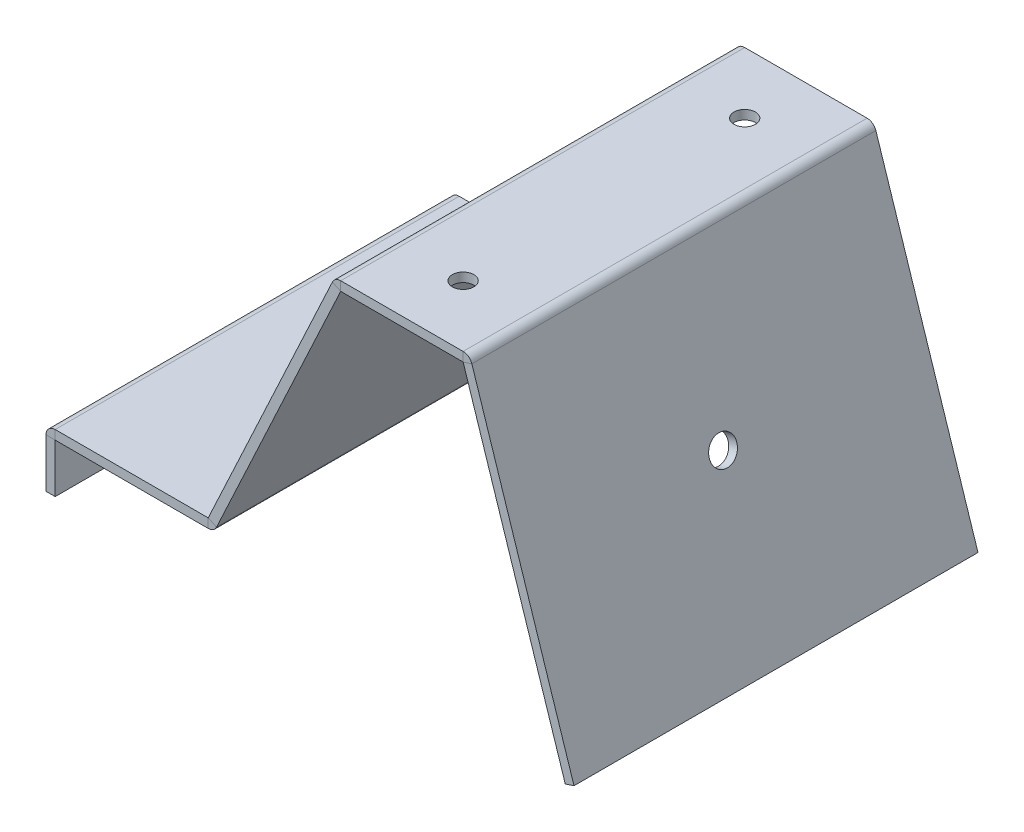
SolidWorks part; units mm, degrees
ref_plane "Front Plane" through (0, 0, 0) normal (0, 0, 1) x (1, 0, 0)
ref_plane "Top Plane" through (0, 0, 0) normal (0, 1, 0) x (1, 0, 0)
ref_plane "Right Plane" through (0, 0, 0) normal (1, 0, 0) x (0, 0, -1)
sketch "Sketch1" plane through (0, 0, 0) normal (0, 1, 0) x (1, 0, 0)
  line L0 (91, 66) -> (91, 0) construction
  line L1 (0, 0) -> (155, 0)
  line L2 (0, 0) -> (0, 66)
  line L3 (0, 66) -> (155, 66)
  line L4 (155, 0) -> (155, 66)
  line L5 (155, 33) -> (0, 33) construction
  circle A0 centre (91, 56) radius 1.75
  circle A1 centre (91, 10) radius 1.75
  circle A2 centre (127, 33) radius 2.25
  dimension "D1" = 4.5
  dimension "D2" = 3.5
  dimension "D3" = 3.5
  dimension "D5" = 10
  dimension "D6" = 10
  dimension "D7" = 28
  dimension "D4" = 66
  dimension "D8" = 64
  dimension "D9" = 155
sheet metal parameters "Sheet-Metal1" thickness 1.5 parameters "D1"=1
base flange "Base-Flange1" sketch "Sketch1" thickness 1.5 reverse thickness direction yes parameters "D1"=1
sketch "Sketch3" plane through (0, 1.5, 0) normal (0, 1, 0) x (1, 0, 0)
  line L0 (8, 66) -> (8, 0)
  line L1 (155, 66) -> (0, 66) construction
  line L2 (0, 0) -> (155, 0) construction
  line L3 (0, 66) -> (0, 0) construction
  dimension "D1" = 8
sketched bend "Sketched Bend1" parameters "D1"=0.001
bend "SketchBend1" bend radius 0.001 bend angle 90 parameters "D5"=1
sketch "Sketch4" plane through (0, 1.5, 0) normal (0, 1, 0) x (1, 0, 0)
  line L0 (33, 0) -> (33, 66)
  line L1 (8.0008, 0) -> (155, 0) construction
  line L2 (155, 66) -> (8.0008, 66) construction
  line L3 (155, 0) -> (155, 66) construction
  dimension "D1" = 122
sketched bend "Sketched Bend2" parameters "D1"=0.001
bend "SketchBend2" bend radius 0.001 bend angle 65 parameters "D5"=2
sketch "Sketch5" plane through (26.5315, -12.3718, 0) normal (-0.9063, 0.4226, 0) x (0, 0, 1)
  line L0 (-66, 63.306) -> (0, 63.306)
  line L1 (-66, 137.306) -> (-66, 15.3065) construction
  line L2 (0, 15.3065) -> (0, 137.306) construction
  line L3 (0, 137.306) -> (-66, 137.306) construction
  dimension "D1" = 74
sketched bend "Sketched Bend3" parameters "D1"=0.001
bend "SketchBend3" bend radius 0.001 bend angle 65 parameters "D5"=3
sketch "Sketch6" plane through (0, 45.869, 0) normal (0, 1, 0) x (1, 0, 0)
  line L0 (74.6453, 66) -> (74.6453, 0)
  line L1 (128.6453, 66) -> (54.6459, 66) construction
  line L2 (54.6459, 0) -> (128.6453, 0) construction
  line L3 (128.6453, 0) -> (128.6453, 66) construction
  dimension "D1" = 54
sketched bend "Sketched Bend4" parameters "D1"=0.001
bend "SketchBend4" bend radius 0.001 bend angle 72 parameters "D5"=4
flat pattern "Flat-Pattern1"
sketch "Bend-Lines1" plane through (0, 0, 0) normal (0, 1, 0) x (-1, 0, 0)
bend of the flat pattern "Flatten-<SketchBend1>1"
bend of the flat pattern "Flatten-<SketchBend2>1"
bend of the flat pattern "Flatten-<SketchBend3>1"
bend of the flat pattern "Flatten-<SketchBend4>1"
